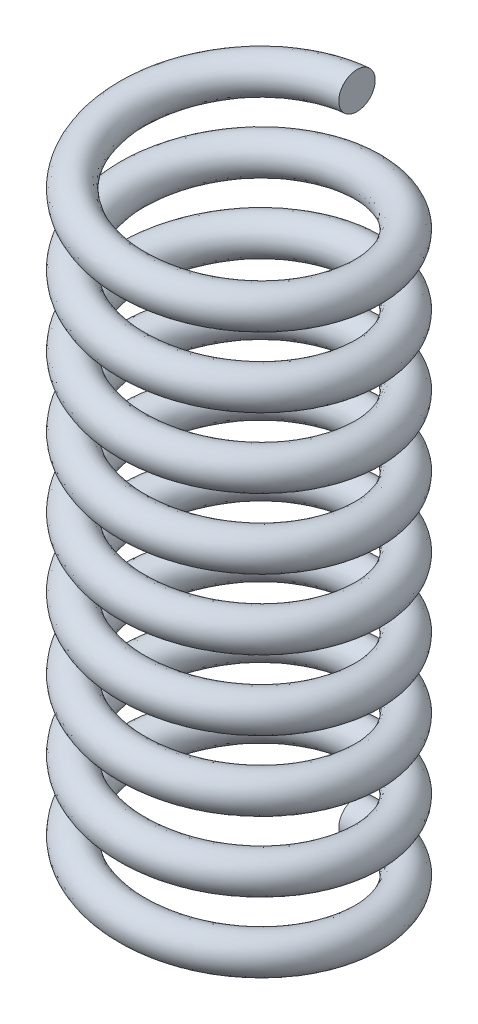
SolidWorks part; units mm, degrees
ref_plane "Ebene vorne" through (0, 0, 0) normal (0, 0, 1) x (1, 0, 0)
ref_plane "Ebene oben" through (0, 0, 0) normal (0, 1, 0) x (1, 0, 0)
ref_plane "Ebene rechts" through (0, 0, 0) normal (1, 0, 0) x (0, 0, -1)
sketch "Skizze1" plane through (0, 0, 0) normal (0, 1, 0) x (1, 0, 0)
  circle A0 centre (0, 0) radius 3.75
  dimension "D1" = 7.5
curve "Spirale/Helix1"
sketch "Skizze2" plane through (0, 0, 0) normal (1, 0, 0) x (0, 0, -1)
  circle A0 centre (3.75, 19.9965) radius 0.58
sweep "Austragung2" add profiles "Skizze2" path "Spirale/Helix1"
